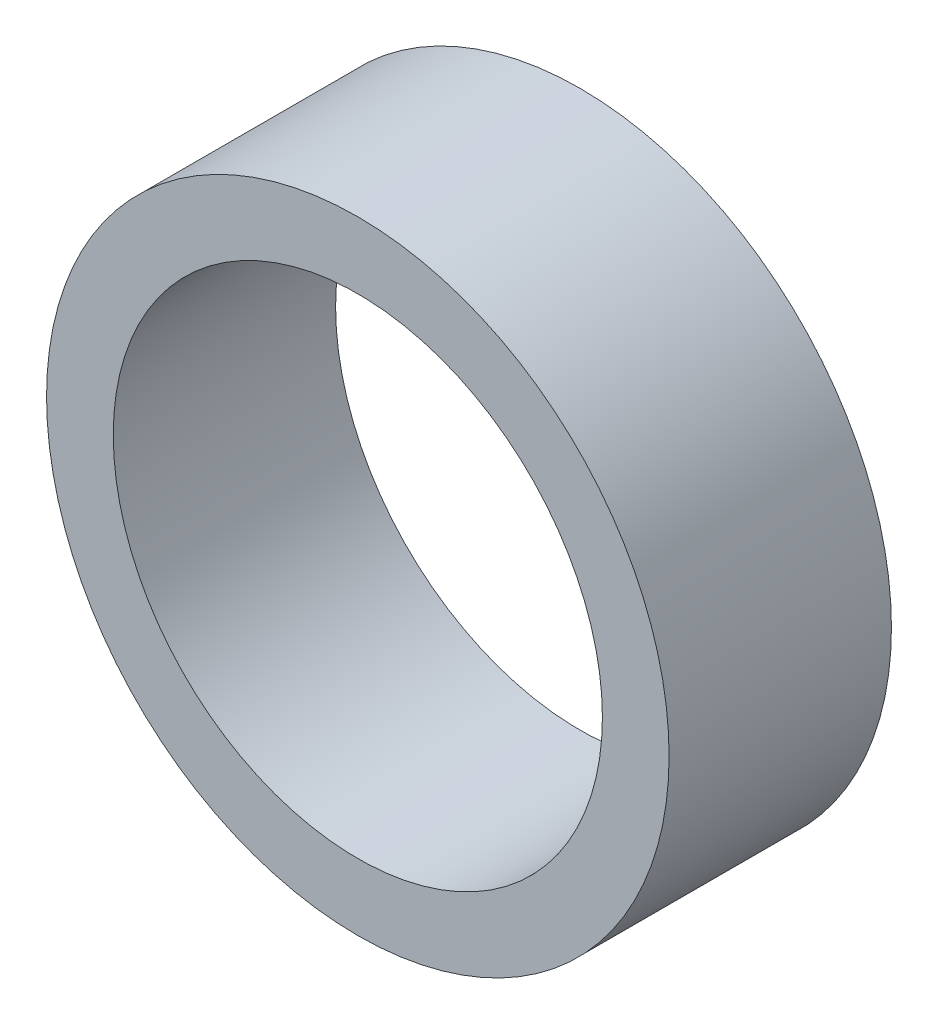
SolidWorks part; units mm, degrees
ref_plane "Front Plane" through (0, 0, 0) normal (0, 0, 1) x (1, 0, 0)
ref_plane "Top Plane" through (0, 0, 0) normal (0, 1, 0) x (1, 0, 0)
ref_plane "Right Plane" through (0, 0, 0) normal (1, 0, 0) x (0, 0, -1)
sketch "Schizzo1" plane through (0, 0, 0) normal (0, 0, 1) x (1, 0, 0)
  circle A0 centre (0, 0) radius 7
  dimension "D1" = 14
extrude "Estrusione-Estrusione1" add sketch "Schizzo1" along normal blind 5
sketch "Schizzo2" plane through (0, 0, 5) normal (0, 0, 1) x (1, 0, 0)
  circle A0 centre (0, 0) radius 5.5
  dimension "D1" = 11
extrude "Taglio-Estrusione1" cut sketch "Schizzo2" against normal blind 35
